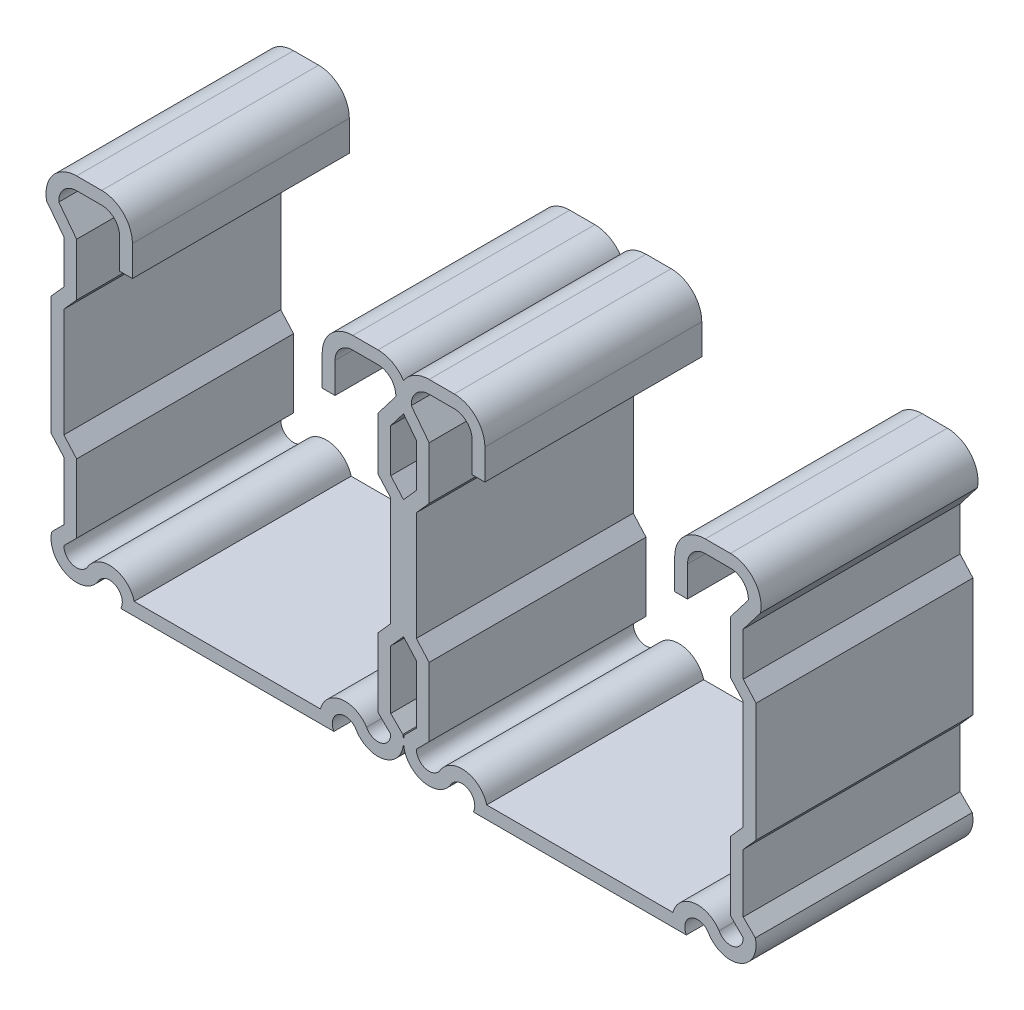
SolidWorks part; units mm, degrees
ref_plane "Plane1" through (0, 0, 0) normal (0, 0, 1) x (1, 0, 0)
ref_plane "Plane2" through (0, 0, 0) normal (0, 1, 0) x (1, 0, 0)
ref_plane "Plane3" through (0, 0, 0) normal (1, 0, 0) x (0, 0, -1)
other "Configuration Table"
sketch "Sketch1" plane through (0, 0, 0) normal (0, 0, 1) x (1, 0, 0)
  line L0 (17.6403, 16.3393) -> (19.7299, 19.0635)
  line L1 (17.6403, -13.9795) -> (19.1389, -15.4781)
  line L2 (-17.6403, -13.9795) -> (-19.1389, -15.4781)
  line L4 (-17.6403, -13.9795) -> (-17.6403, -5.9368)
  line L5 (17.6403, 21.2598) -> (14.7033, 21.2598)
  line L6 (12.6111, 19.1676) -> (12.6111, 15.6147)
  line L7 (-17.6403, -5.9368) -> (-19.1389, -4.2539)
  line L8 (-12.6111, 19.1676) -> (-12.6111, 15.6147)
  line L9 (0, 10.16) -> (0, -7.62) construction
  line L10 (-19.1389, -4.2539) -> (-19.1389, 8.4957)
  line L11 (-17.6403, 10.1786) -> (-19.1389, 8.4957)
  line L12 (-17.6403, 10.1786) -> (-17.6403, 16.3393)
  line L13 (-17.6403, 16.3393) -> (-19.7299, 19.0635)
  line L14 (-17.6403, 21.2598) -> (-14.7033, 21.2598)
  line L16 (17.6403, -13.9795) -> (17.6403, -5.9368)
  line L17 (17.6403, 10.1786) -> (17.6403, 16.3393)
  line L18 (-11.1125, 19.1676) -> (-11.1125, 15.6147)
  line L19 (-17.6403, 22.7584) -> (-14.7033, 22.7584)
  line L20 (-19.1389, 15.8307) -> (-21.1624, 18.4689)
  line L21 (-19.1389, 10.7491) -> (-19.1389, 15.8307)
  line L22 (-19.1389, 10.7491) -> (-20.6375, 9.0662)
  line L23 (-20.6375, -4.8244) -> (-20.6375, 9.0662)
  line L24 (-19.1389, -6.5073) -> (-20.6375, -4.8244)
  line L25 (19.1389, -4.2539) -> (19.1389, 8.4957)
  line L26 (-19.1389, -13.3588) -> (-19.1389, -6.5073)
  line L27 (-19.1389, -13.3588) -> (-20.5535, -14.7733)
  line L28 (11.1125, 19.1676) -> (11.1125, 15.6147)
  line L29 (17.6403, 22.7584) -> (14.7033, 22.7584)
  line L30 (19.1389, 15.8307) -> (21.1624, 18.4689)
  line L31 (19.1389, 10.7491) -> (19.1389, 15.8307)
  line L32 (19.1389, 10.7491) -> (20.6375, 9.0662)
  line L33 (20.6375, -4.8244) -> (20.6375, 9.0662)
  line L34 (19.1389, -6.5073) -> (20.6375, -4.8244)
  line L35 (19.1389, -13.3588) -> (19.1389, -6.5073)
  line L36 (19.1389, -13.3588) -> (20.5535, -14.7733)
  line L37 (17.6403, -5.9368) -> (19.1389, -4.2539)
  line L38 (-12.4806, -18.5166) -> (12.4806, -18.5166)
  line L39 (17.6403, 10.1786) -> (19.1389, 8.4957)
  line L41 (-10.899, -17.018) -> (10.899, -17.018)
  line L42 (-12.6111, 15.6147) -> (-11.1125, 15.6147)
  line L43 (11.1125, 15.6147) -> (12.6111, 15.6147)
  arc A0 (19.1389, -15.4781) -> (16.3052, -16.1588) centre (17.6403, -15.4781) cw
  arc A1 (16.3052, -16.1588) -> (10.899, -17.018) centre (13.7938, -17.7947) ccw
  arc A2 (-16.4143, -16.3399) -> (-10.899, -17.018) centre (-13.7938, -17.7947) cw
  arc A3 (-19.1389, -15.4781) -> (-16.4143, -16.3399) centre (-17.6403, -15.4781) ccw
  arc A4 (-17.6403, 21.2598) -> (-19.7299, 19.0635) centre (-17.6403, 19.1676) ccw
  arc A5 (-12.6111, 19.1676) -> (-14.7033, 21.2598) centre (-14.7033, 19.1676) ccw
  arc A6 (17.6403, 21.2598) -> (19.7299, 19.0635) centre (17.6403, 19.1676) cw
  arc A7 (12.6111, 19.1676) -> (14.7033, 21.2598) centre (14.7033, 19.1676) cw
  arc A8 (-11.1125, 19.1676) -> (-14.7033, 22.7584) centre (-14.7033, 19.1676) ccw
  arc A9 (-17.6403, 22.7584) -> (-21.1624, 18.4689) centre (-17.6403, 19.1676) ccw
  arc A10 (-20.5535, -14.7733) -> (-15.0198, -16.9329) centre (-17.6403, -15.4781) ccw
  arc A11 (11.1125, 19.1676) -> (14.7033, 22.7584) centre (14.7033, 19.1676) cw
  arc A12 (17.6403, 22.7584) -> (21.1624, 18.4689) centre (17.6403, 19.1676) cw
  arc A13 (20.5535, -14.7733) -> (15.0198, -16.9329) centre (17.6403, -15.4781) cw
  arc A14 (15.0198, -16.9329) -> (12.4806, -18.5166) centre (13.7938, -17.7947) ccw
  arc A15 (-15.0198, -16.9329) -> (-12.4806, -18.5166) centre (-13.7938, -17.7947) cw
  dimension "D9" = 7.1437
  dimension "base" = 18.5166
  dimension "D5" = 9.525
  dimension "ToeHt" = 22.7584
  dimension "D6" = 22.225
  dimension "D8" = 15.4781
  dimension "D12" = 41.275
  dimension "D14" = 13.6922
  dimension "D15" = 13.8906
extrude "Base-Extrude" add sketch "Sketch1" along normal mid plane 25.4
pattern_linear "LPattern2" count 2 spacing 41.2725 along (1, 0, 0) of "Base-Extrude"
